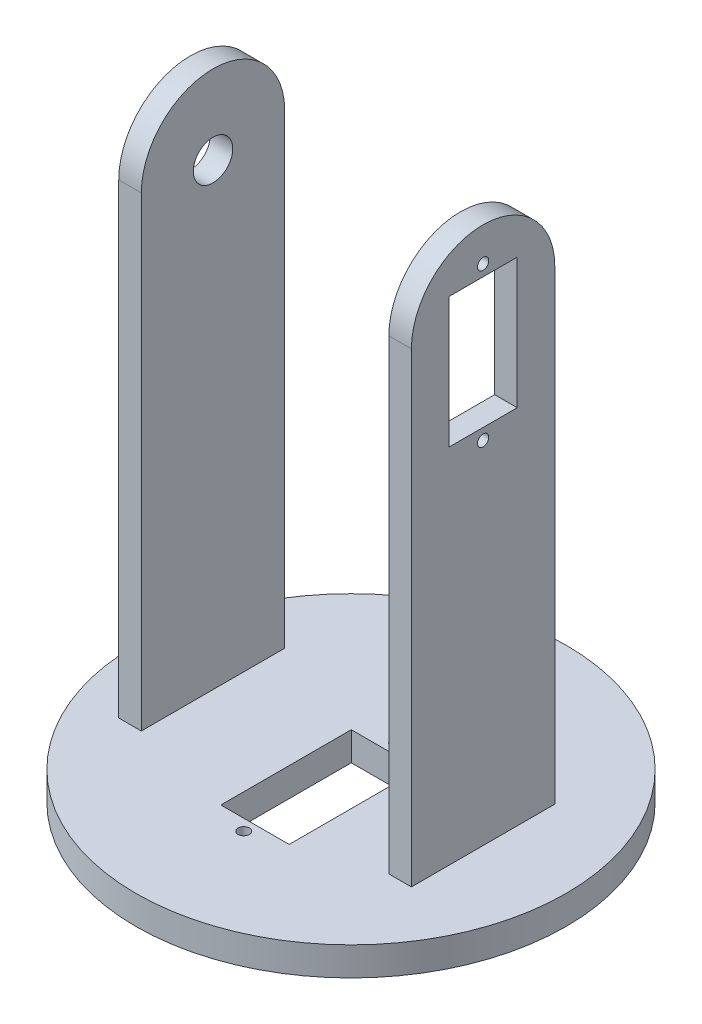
SolidWorks part; units mm, degrees
ref_plane "Front Plane" through (0, 0, 0) normal (0, 0, 1) x (1, 0, 0)
ref_plane "Top Plane" through (0, 0, 0) normal (0, 1, 0) x (1, 0, 0)
ref_plane "Right Plane" through (0, 0, 0) normal (1, 0, 0) x (0, 0, -1)
sketch "Sketch1" plane through (0, 0, 0) normal (0, 1, 0) x (1, 0, 0)
  circle A0 centre (0, 0) radius 38.1
  dimension "D1" = 76.2
extrude "Boss-Extrude1" add sketch "Sketch1" along normal blind 5.08
sketch "Sketch2" plane through (0, 5.08, 0) normal (0, 1, 0) x (1, 0, 0)
  line L1 (-28.448, 12.7) -> (-24.448, 12.7)
  line L2 (-28.448, 12.7) -> (-28.448, -12.7)
  line L3 (-28.448, -12.7) -> (-24.448, -12.7)
  line L4 (-24.448, 12.7) -> (-24.448, -12.7)
  line L5 (19.4, 12.7) -> (23.4, 12.7)
  line L6 (19.4, 12.7) -> (19.4, -12.7)
  line L7 (19.4, -12.7) -> (23.4, -12.7)
  line L8 (23.4, 12.7) -> (23.4, -12.7)
  point P8 (-24.448, 0)
  point P9 (19.4, 0)
  dimension "D1" = 25.4
  dimension "D2" = 25.4
  dimension "D3" = 28.448
  dimension "D4" = 4
  dimension "D5" = 4
  dimension "D6" = 23.4
extrude "Boss-Extrude2" add sketch "Sketch2" along normal blind 95.25
sketch "Sketch3" plane through (23.4, 0, 0) normal (1, 0, 0) x (0, 0, -1)
  line L0 (-12.7, 100.33) -> (12.7, 100.33) construction
  line L1 (-6.05, 92.33) -> (6.05, 92.33)
  line L2 (-6.05, 92.33) -> (-6.05, 69.23)
  line L3 (-6.05, 69.23) -> (6.05, 69.23)
  line L4 (6.05, 92.33) -> (6.05, 69.23)
  line L5 (-6.05, 92.33) -> (6.05, 69.23) construction
  circle A0 centre (0, 67.23) radius 1
  circle A1 centre (0, 94.33) radius 1
  point P4 (0, 100.33)
  point P9 (0, 92.33)
  point P14 (0, 80.78)
  dimension "D4" = 2
  dimension "D5" = 2
  dimension "D1" = 12.1
  dimension "D2" = 23.1
  dimension "D3" = 8
  dimension "D6" = 2
  dimension "D7" = 2
extrude "Cut-Extrude2" cut sketch "Sketch3" against normal up to next
sketch "Sketch4" plane through (23.4, 0, 0) normal (1, 0, 0) x (0, 0, -1)
  line L0 (-12.7, 100.33) -> (-12.7, 87.63)
  line L1 (-12.7, 100.33) -> (-12.7, 5.08) construction
  line L2 (12.7, 100.33) -> (12.7, 5.08) construction
  line L3 (-12.7, 100.33) -> (12.7, 100.33)
  line L4 (12.7, 100.33) -> (12.7, 87.63)
  arc A0 (-12.7, 87.63) -> (12.7, 87.63) centre (0, 87.63) cw
  dimension "D1" = 12.7
extrude "Cut-Extrude3" cut sketch "Sketch4" against normal through all contours A0 L3 M10 | A0 M9 M8
sketch "Sketch5" plane through (-28.448, 0, 0) normal (-1, 0, 0) x (0, 0, 1)
  circle A0 centre (0, 86.33) radius 3.5
  arc A1 (12.7, 87.63) -> (-12.7, 87.63) centre (0, 87.63) ccw construction
  point P5 (0, 100.33)
  dimension "D2" = 7
  dimension "D1" = 14
extrude "Cut-Extrude4" cut sketch "Sketch5" against normal up to next
sketch "Sketch6" plane through (0, 5.08, 0) normal (0, 1, 0) x (1, 0, 0)
  line L0 (-6.05, 6.096) -> (6.05, 6.096)
  line L1 (-6.05, 6.096) -> (-6.05, -17.004)
  line L2 (-6.05, -17.004) -> (6.05, -17.004)
  line L3 (6.05, 6.096) -> (6.05, -17.004)
  circle A1 centre (0, -19.004) radius 1
  circle A2 centre (0, 8.096) radius 1
  point P5 (0, 6.096)
  dimension "D1" = 12.1
  dimension "D3" = 2
  dimension "D4" = 2
  dimension "D2" = 23.1
  dimension "D5" = 2
  dimension "D6" = 2
  dimension "D7" = 6.096
extrude "Cut-Extrude5" cut sketch "Sketch6" against normal up to next
